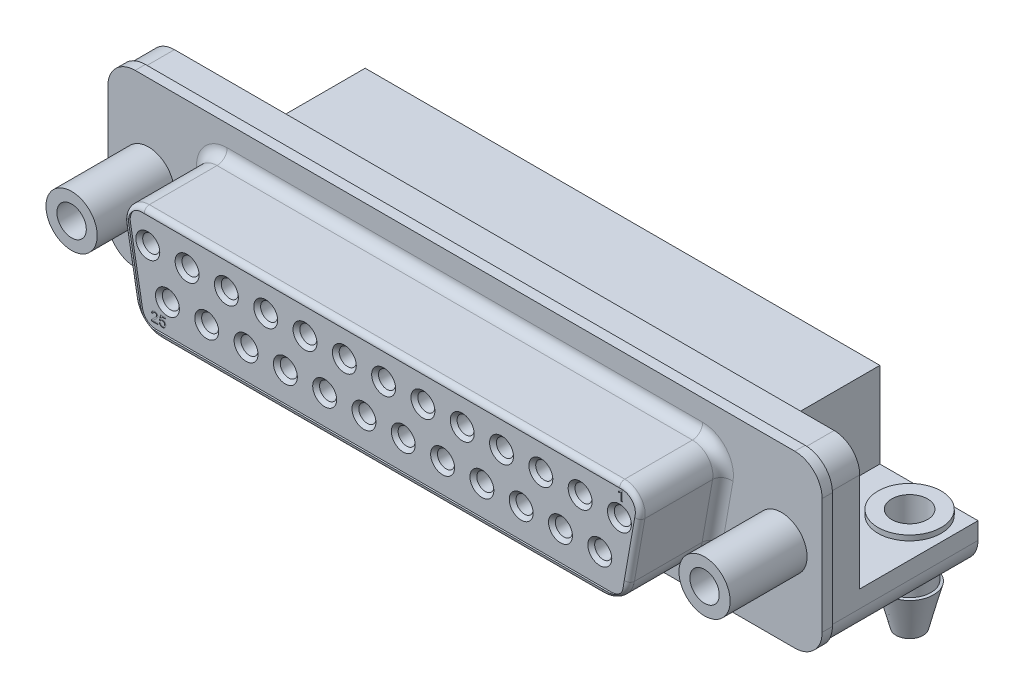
SolidWorks part; units mm, degrees
ref_plane "FRONT" through (0, 0, 0) normal (0, 0, 1) x (1, 0, 0)
ref_plane "TOP" through (0, 0, 0) normal (0, 1, 0) x (1, 0, 0)
ref_plane "RIGHT" through (0, 0, 0) normal (1, 0, 0) x (0, 0, -1)
sketch "Sketch1" plane through (0, 0, 0) normal (0, 0, 1) x (1, 0, 0)
  line L0 (26.545, 0) -> (-26.545, 0) construction
  line L1 (-24.513, -6.3373) -> (24.513, -6.3373)
  line L2 (-26.545, -4.3053) -> (-26.545, 4.3053)
  line L3 (-24.513, 6.3373) -> (24.513, 6.3373)
  line L4 (26.545, -4.3053) -> (26.545, 4.3053)
  line L5 (0, 6.3373) -> (0, -6.3373) construction
  arc A0 (-26.545, -4.3053) -> (-24.513, -6.3373) centre (-24.513, -4.3053) ccw
  arc A1 (-24.513, 6.3373) -> (-26.545, 4.3053) centre (-24.513, 4.3053) ccw
  arc A2 (26.545, 4.3053) -> (24.513, 6.3373) centre (24.513, 4.3053) ccw
  arc A3 (26.545, -4.3053) -> (24.513, -6.3373) centre (24.513, -4.3053) cw
  circle A4 centre (23.5204, 0) radius 1.0922
  circle A5 centre (-23.5204, 0) radius 1.0922
  dimension "D3" = 2.032
  dimension "D4" = 2.1844
  dimension "D5" = 23.5204
  dimension "D1" = 12.6746
  dimension "D2" = 53.09
extrude "Base-Extrude" add sketch "Sketch1" along normal blind 0.762
sketch "Sketch2" plane through (0, 0, 0.762) normal (0, 0, 1) x (1, 0, 0)
  line L0 (0, 6.3373) -> (0, -6.3373) construction
  line L1 (24.513, 6.3373) -> (-24.513, 6.3373) construction
  line L2 (-24.513, -6.3373) -> (24.513, -6.3373) construction
  line L4 (-17.6657, 4.0132) -> (17.6657, 4.0132)
  line L5 (-16.384, -3.8862) -> (16.384, -3.8862)
  line L6 (19.1665, 2.2246) -> (18.3851, -2.2071)
  line L7 (-19.1665, 2.2246) -> (-18.3851, -2.2071)
  arc A0 (19.1665, 2.2246) -> (17.6657, 4.0132) centre (17.6657, 2.4892) ccw
  arc A1 (18.3851, -2.2071) -> (16.384, -3.8862) centre (16.384, -1.8542) cw
  arc A2 (-18.3851, -2.2071) -> (-16.384, -3.8862) centre (-16.384, -1.8542) ccw
  arc A3 (-19.1665, 2.2246) -> (-17.6657, 4.0132) centre (-17.6657, 2.4892) cw
  point P10 (0, 4.0132)
  point P22 (0, -3.8862)
  dimension "D4" = 1.524
  dimension "D5" = 2.032
  dimension "D1" = 38.3794
  dimension "D2" = 100
  dimension "D3" = 7.8994
  dimension "D6" = 2.3241
extrude "Pin  Boss" add sketch "Sketch2" along normal blind 6.1722
fillet "Fillet1" radius 0.762 8 edges at (18.8332, 3.4688, 0.762) (0, 4.0132, 0.762) (-18.8332, 3.4688, 0.762) (-18.7758, 0.0088, 0.762) (-17.6901, -3.4108, 0.762) (0, -3.8862, 0.762) (17.6901, -3.4108, 0.762) (18.7758, 0.0088, 0.762)
fillet "Fillet2" radius 0.381 8 edges at (18.8332, 3.4688, 6.9342) (0, 4.0132, 6.9342) (-18.8332, 3.4688, 6.9342) (-18.7758, 0.0088, 6.9342) (-17.6901, -3.4108, 6.9342) (0, -3.8862, 6.9342) (17.6901, -3.4108, 6.9342) (18.7758, 0.0088, 6.9342)
sketch "Sketch3" plane through (0, 0, 6.9342) normal (0, 0, 1) x (1, 0, 0)
  line L0 (0, 6.3373) -> (0, -6.3373) construction
  line L1 (24.513, 6.3373) -> (-24.513, 6.3373) construction
  line L2 (-24.513, -6.3373) -> (24.513, -6.3373) construction
  line L3 (-17.8171, 3.6322) -> (17.8171, 3.6322)
  line L4 (-16.9168, -3.5052) -> (16.9168, -3.5052)
  line L5 (18.8176, 2.4398) -> (17.9174, -2.6656)
  line L6 (-16.384, -3.5052) -> (16.384, -3.5052) construction
  line L7 (18.0099, -2.1409) -> (18.7913, 2.2907) construction
  line L8 (17.6657, 3.6322) -> (-17.6657, 3.6322) construction
  line L9 (-18.8176, 2.4398) -> (-17.9174, -2.6656)
  arc A0 (18.8176, 2.4398) -> (17.8171, 3.6322) centre (17.8171, 2.6162) ccw
  arc A1 (17.9174, -2.6656) -> (16.9168, -3.5052) centre (16.9168, -2.4892) cw
  arc A2 (-17.9174, -2.6656) -> (-16.9168, -3.5052) centre (-16.9168, -2.4892) ccw
  arc A3 (-18.8176, 2.4398) -> (-17.8171, 3.6322) centre (-17.8171, 2.6162) cw
  point P6 (-17.6657, 3.6322)
  point P9 (0, 3.6322)
  point P15 (17.6657, 3.6322)
  point P28 (0, -3.5052)
  dimension "D2" = 1.016
extrude "Pin Face Releif" cut sketch "Sketch3" against normal blind 0.127
sketch "Sketch5" plane through (0, 0, 0) normal (0, 0, -1) x (-1, 0, 0)
  line L18 (26.418, -4.3053) -> (26.418, 4.3053)
  line L19 (24.513, 6.2103) -> (-24.513, 6.2103)
  line L20 (-26.418, 4.3053) -> (-26.418, -4.3053)
  line L21 (-24.513, -6.2103) -> (24.513, -6.2103)
  line L22 (26.418, -4.3053) -> (26.418, 4.3053)
  line L23 (24.513, 6.2103) -> (-24.513, 6.2103)
  line L24 (-26.418, 4.3053) -> (-26.418, -4.3053)
  line L25 (-24.513, -6.2103) -> (24.513, -6.2103)
  arc A16 (24.513, -6.2103) -> (26.418, -4.3053) centre (24.513, -4.3053) ccw
  arc A17 (26.418, 4.3053) -> (24.513, 6.2103) centre (24.513, 4.3053) ccw
  arc A18 (-24.513, 6.2103) -> (-26.418, 4.3053) centre (-24.513, 4.3053) ccw
  arc A19 (-26.418, -4.3053) -> (-24.513, -6.2103) centre (-24.513, -4.3053) ccw
  arc A20 (24.513, -6.2103) -> (26.418, -4.3053) centre (24.513, -4.3053) ccw
  arc A21 (26.418, 4.3053) -> (24.513, 6.2103) centre (24.513, 4.3053) ccw
  arc A22 (-24.513, 6.2103) -> (-26.418, 4.3053) centre (-24.513, 4.3053) ccw
  arc A23 (-26.418, -4.3053) -> (-24.513, -6.2103) centre (-24.513, -4.3053) ccw
  dimension "D1" = 0.127
extrude "BACKSIDE BOSS" add sketch "Sketch5" along normal offset from surface (2.159 mm away) 2.921
sketch "Sketch7" plane through (0, 0, -2.159) normal (0, 0, -1) x (-1, 0, 0)
  line L0 (24.513, -6.2103) -> (-24.513, -6.2103) construction
  line L1 (24.513, -6.2103) -> (-24.513, -6.2103)
  line L2 (26.418, -3.0353) -> (19.1262, -3.0353)
  line L3 (26.418, 4.3053) -> (26.418, -4.3053) construction
  line L4 (19.1262, -3.0353) -> (19.1262, 3.3147)
  line L5 (19.1262, 3.3147) -> (-19.1262, 3.3147)
  line L6 (0, 0) -> (0, 12.7531) construction
  line L7 (26.418, -3.0353) -> (26.418, -4.3053)
  line L8 (-26.418, -3.0353) -> (-26.418, -4.3053)
  line L13 (-19.1262, -3.0353) -> (-19.1262, 3.3147)
  line L14 (-26.418, -3.0353) -> (-19.1262, -3.0353)
  arc A0 (-26.418, -4.3053) -> (-24.513, -6.2103) centre (-24.513, -4.3053) ccw construction
  arc A1 (24.513, -6.2103) -> (26.418, -4.3053) centre (24.513, -4.3053) ccw construction
  arc A2 (-26.418, -4.3053) -> (-24.513, -6.2103) centre (-24.513, -4.3053) ccw
  arc A3 (24.513, -6.2103) -> (26.418, -4.3053) centre (24.513, -4.3053) ccw
  point P15 (0, 3.3147)
  dimension "D1" = 3.175
  dimension "D2" = 9.525
  dimension "D3" = 38.2524
extrude "backside#2" add sketch "Sketch7" along normal offset from surface (8.7884 mm away) 11.7094
sketch "Sketch10" plane through (0, 0, 6.8072) normal (0, 0, 1) x (1, 0, 0)
  line L0 (0, 0) -> (0, 10.8774) construction
  circle A0 centre (0, 1.5875) radius 0.635
  circle A1 centre (2.921, 1.5875) radius 0.635
  circle A2 centre (5.842, 1.5875) radius 0.635
  circle A3 centre (8.763, 1.5875) radius 0.635
  circle A4 centre (11.684, 1.5875) radius 0.635
  circle A5 centre (14.605, 1.5875) radius 0.635
  circle A6 centre (17.526, 1.5875) radius 0.635
  circle A7 centre (-17.526, 1.5875) radius 0.635
  circle A8 centre (-14.605, 1.5875) radius 0.635
  circle A9 centre (-11.684, 1.5875) radius 0.635
  circle A10 centre (-8.763, 1.5875) radius 0.635
  circle A11 centre (-5.842, 1.5875) radius 0.635
  circle A12 centre (-2.921, 1.5875) radius 0.635
  dimension "D1" = 1.5875
  dimension "D2" = 1.27
extrude "TOP ROW HOLES" cut sketch "Sketch10" against normal blind 6.35
sketch "Sketch11" plane through (0, 0, 6.8072) normal (0, 0, 1) x (1, 0, 0)
  line L0 (-2.921, 1.5875) -> (0, 1.5875) construction
  line L1 (-1.4605, 1.5875) -> (-1.4605, -3.102) construction
  line L2 (-26.289, 1.5875) -> (-23.368, 1.5875) construction
  line L3 (-24.8285, 1.5875) -> (-24.8285, -1.3335) construction
  line L4 (0, 0) -> (0, -9.5373) construction
  circle A1 centre (0, 1.5875) radius 0.635 construction
  circle A2 centre (-4.3815, -1.3335) radius 0.635
  circle A3 centre (-7.3025, -1.3335) radius 0.635
  circle A4 centre (-10.2235, -1.3335) radius 0.635
  circle A5 centre (-13.1445, -1.3335) radius 0.635
  circle A6 centre (-16.0655, -1.3335) radius 0.635
  circle A7 centre (1.4605, -1.3335) radius 0.635
  circle A8 centre (16.0655, -1.3335) radius 0.635
  circle A9 centre (13.1445, -1.3335) radius 0.635
  circle A10 centre (-1.4605, -1.3335) radius 0.635
  circle A11 centre (10.2235, -1.3335) radius 0.635
  circle A12 centre (7.3025, -1.3335) radius 0.635
  circle A13 centre (4.3815, -1.3335) radius 0.635
extrude "BOTTOM ROW HOLES" cut sketch "Sketch11" against normal blind 6.35
chamfer "Chamfer2" distance 0.254 angle 45 25 edges at (0.635, 1.5875, 6.8072) (3.556, 1.5875, 6.8072) (6.477, 1.5875, 6.8072) (9.398, 1.5875, 6.8072) (12.319, 1.5875, 6.8072) (15.24, 1.5875, 6.8072) (18.161, 1.5875, 6.8072) (-18.161, 1.5875, 6.8072) (-15.24, 1.5875, 6.8072) (-12.319, 1.5875, 6.8072) (-9.398, 1.5875, 6.8072) (-6.477, 1.5875, 6.8072) (-3.556, 1.5875, 6.8072) (-3.7465, -1.3335, 6.8072) (-6.6675, -1.3335, 6.8072) (-9.5885, -1.3335, 6.8072) (-12.5095, -1.3335, 6.8072) (-15.4305, -1.3335, 6.8072) (0.8255, -1.3335, 6.8072) (15.4305, -1.3335, 6.8072) (-0.8255, -1.3335, 6.8072) (12.5095, -1.3335, 6.8072) (9.5885, -1.3335, 6.8072) (6.6675, -1.3335, 6.8072) (3.7465, -1.3335, 6.8072)
sketch "Sketch13" plane through (0, -6.2103, 0) normal (0, -1, 0) x (1, 0, 0)
  line L0 (18.6964, -10.8204) -> (19.3314, -10.8204)
  line L1 (18.6964, -10.8204) -> (18.6964, -10.1854)
  line L2 (-16.635, -10.8204) -> (-16, -10.8204)
  line L3 (-16.635, -10.8204) -> (-16.635, -10.1854)
  line L4 (-16.635, -10.1854) -> (-16, -10.1854)
  line L5 (-16, -10.8204) -> (-16, -10.1854)
  line L6 (26.545, 0.762) -> (26.545, 0) construction
  line L7 (26.545, 0.762) -> (26.545, 0) construction
  line L8 (0, 0) -> (0, -18.529) construction
  line L10 (-16.3175, -10.1854) -> (-16.3175, -9.6524) construction
  line L11 (-13.9172, -10.8204) -> (-13.2822, -10.8204)
  line L12 (-13.9172, -10.8204) -> (-13.9172, -10.1854)
  line L13 (-13.9172, -10.1854) -> (-13.2822, -10.1854)
  line L14 (-13.2822, -10.8204) -> (-13.2822, -10.1854)
  line L15 (-11.1994, -10.8204) -> (-10.5644, -10.8204)
  line L16 (-11.1994, -10.8204) -> (-11.1994, -10.1854)
  line L17 (-11.1994, -10.1854) -> (-10.5644, -10.1854)
  line L18 (-10.5644, -10.8204) -> (-10.5644, -10.1854)
  line L19 (-8.4816, -10.8204) -> (-7.8466, -10.8204)
  line L20 (-8.4816, -10.8204) -> (-8.4816, -10.1854)
  line L21 (-8.4816, -10.1854) -> (-7.8466, -10.1854)
  line L22 (-7.8466, -10.8204) -> (-7.8466, -10.1854)
  line L23 (-5.7638, -10.8204) -> (-5.1288, -10.8204)
  line L24 (-5.7638, -10.8204) -> (-5.7638, -10.1854)
  line L25 (-5.7638, -10.1854) -> (-5.1288, -10.1854)
  line L26 (-5.1288, -10.8204) -> (-5.1288, -10.1854)
  line L27 (-3.046, -10.8204) -> (-2.411, -10.8204)
  line L28 (-3.046, -10.8204) -> (-3.046, -10.1854)
  line L29 (-3.046, -10.1854) -> (-2.411, -10.1854)
  line L30 (-2.411, -10.8204) -> (-2.411, -10.1854)
  line L31 (-0.3282, -10.8204) -> (0.3068, -10.8204)
  line L32 (-0.3282, -10.8204) -> (-0.3282, -10.1854)
  line L33 (-0.3282, -10.1854) -> (0.3068, -10.1854)
  line L34 (0.3068, -10.8204) -> (0.3068, -10.1854)
  line L35 (2.3896, -10.8204) -> (3.0246, -10.8204)
  line L36 (2.3896, -10.8204) -> (2.3896, -10.1854)
  line L37 (2.3896, -10.1854) -> (3.0246, -10.1854)
  line L38 (3.0246, -10.8204) -> (3.0246, -10.1854)
  line L39 (5.1074, -10.8204) -> (5.7424, -10.8204)
  line L40 (5.1074, -10.8204) -> (5.1074, -10.1854)
  line L41 (5.1074, -10.1854) -> (5.7424, -10.1854)
  line L42 (5.7424, -10.8204) -> (5.7424, -10.1854)
  line L43 (7.8252, -10.8204) -> (8.4602, -10.8204)
  line L44 (7.8252, -10.8204) -> (7.8252, -10.1854)
  line L45 (7.8252, -10.1854) -> (8.4602, -10.1854)
  line L46 (8.4602, -10.8204) -> (8.4602, -10.1854)
  line L47 (10.543, -10.8204) -> (11.178, -10.8204)
  line L48 (10.543, -10.8204) -> (10.543, -10.1854)
  line L49 (10.543, -10.1854) -> (11.178, -10.1854)
  line L50 (11.178, -10.8204) -> (11.178, -10.1854)
  line L51 (13.2608, -10.8204) -> (13.8958, -10.8204)
  line L52 (13.2608, -10.8204) -> (13.2608, -10.1854)
  line L53 (13.2608, -10.1854) -> (13.8958, -10.1854)
  line L54 (13.8958, -10.8204) -> (13.8958, -10.1854)
  line L55 (15.9786, -10.8204) -> (16.6136, -10.8204)
  line L56 (15.9786, -10.8204) -> (15.9786, -10.1854)
  line L57 (15.9786, -10.1854) -> (16.6136, -10.1854)
  line L58 (16.6136, -10.8204) -> (16.6136, -10.1854)
  line L59 (18.6964, -10.1854) -> (19.3314, -10.1854)
  line L60 (19.3314, -10.8204) -> (19.3314, -10.1854)
  line L61 (21.4142, -10.8204) -> (22.0492, -10.8204)
  line L62 (21.4142, -10.8204) -> (21.4142, -10.1854)
  line L63 (21.4142, -10.1854) -> (22.0492, -10.1854)
  line L64 (22.0492, -10.8204) -> (22.0492, -10.1854)
  line L65 (24.132, -10.8204) -> (24.767, -10.8204)
  line L66 (24.132, -10.8204) -> (24.132, -10.1854)
  line L67 (24.132, -10.1854) -> (24.767, -10.1854)
  line L68 (24.767, -10.8204) -> (24.767, -10.1854)
  line L69 (26.8498, -10.8204) -> (27.4848, -10.8204)
  line L70 (26.8498, -10.8204) -> (26.8498, -10.1854)
  line L71 (26.8498, -10.1854) -> (27.4848, -10.1854)
  line L72 (27.4848, -10.8204) -> (27.4848, -10.1854)
  line L73 (29.5676, -10.8204) -> (30.2026, -10.8204)
  line L74 (29.5676, -10.8204) -> (29.5676, -10.1854)
  line L75 (29.5676, -10.1854) -> (30.2026, -10.1854)
  line L76 (30.2026, -10.8204) -> (30.2026, -10.1854)
  line L77 (32.2854, -10.8204) -> (32.9204, -10.8204)
  line L78 (32.2854, -10.8204) -> (32.2854, -10.1854)
  line L79 (32.2854, -10.1854) -> (32.9204, -10.1854)
  line L80 (32.9204, -10.8204) -> (32.9204, -10.1854)
  line L81 (17.3502, -7.4498) -> (17.9852, -7.4498)
  line L82 (17.3502, -7.4498) -> (17.3502, -8.0848)
  line L83 (-14.9459, -8.0848) -> (-14.9459, -8.3778) construction
  line L84 (-15.2634, -7.4498) -> (-14.6284, -7.4498)
  line L85 (-15.2634, -7.4498) -> (-15.2634, -8.0848)
  line L86 (-15.2634, -8.0848) -> (-14.6284, -8.0848)
  line L87 (-14.6284, -7.4498) -> (-14.6284, -8.0848)
  line L88 (-12.5456, -7.4498) -> (-11.9106, -7.4498)
  line L89 (-12.5456, -7.4498) -> (-12.5456, -8.0848)
  line L90 (-12.5456, -8.0848) -> (-11.9106, -8.0848)
  line L91 (-11.9106, -7.4498) -> (-11.9106, -8.0848)
  line L92 (-12.2281, -8.0848) -> (-12.2281, -8.3778) construction
  line L93 (-9.8278, -7.4498) -> (-9.1928, -7.4498)
  line L94 (-9.8278, -7.4498) -> (-9.8278, -8.0848)
  line L95 (-9.8278, -8.0848) -> (-9.1928, -8.0848)
  line L96 (-9.1928, -7.4498) -> (-9.1928, -8.0848)
  line L97 (-9.5103, -8.0848) -> (-9.5103, -8.3778) construction
  line L98 (-7.11, -7.4498) -> (-6.475, -7.4498)
  line L99 (-7.11, -7.4498) -> (-7.11, -8.0848)
  line L100 (-7.11, -8.0848) -> (-6.475, -8.0848)
  line L101 (-6.475, -7.4498) -> (-6.475, -8.0848)
  line L102 (-6.7925, -8.0848) -> (-6.7925, -8.3778) construction
  line L103 (-4.3922, -7.4498) -> (-3.7572, -7.4498)
  line L104 (-4.3922, -7.4498) -> (-4.3922, -8.0848)
  line L105 (-4.3922, -8.0848) -> (-3.7572, -8.0848)
  line L106 (-3.7572, -7.4498) -> (-3.7572, -8.0848)
  line L107 (-4.0747, -8.0848) -> (-4.0747, -8.3778) construction
  line L108 (-1.6744, -7.4498) -> (-1.0394, -7.4498)
  line L109 (-1.6744, -7.4498) -> (-1.6744, -8.0848)
  line L110 (-1.6744, -8.0848) -> (-1.0394, -8.0848)
  line L111 (-1.0394, -7.4498) -> (-1.0394, -8.0848)
  line L112 (-1.3569, -8.0848) -> (-1.3569, -8.3778) construction
  line L113 (1.0434, -7.4498) -> (1.6784, -7.4498)
  line L114 (1.0434, -7.4498) -> (1.0434, -8.0848)
  line L115 (1.0434, -8.0848) -> (1.6784, -8.0848)
  line L116 (1.6784, -7.4498) -> (1.6784, -8.0848)
  line L117 (1.3609, -8.0848) -> (1.3609, -8.3778) construction
  line L118 (3.7612, -7.4498) -> (4.3962, -7.4498)
  line L119 (3.7612, -7.4498) -> (3.7612, -8.0848)
  line L120 (3.7612, -8.0848) -> (4.3962, -8.0848)
  line L121 (4.3962, -7.4498) -> (4.3962, -8.0848)
  line L122 (4.0787, -8.0848) -> (4.0787, -8.3778) construction
  line L123 (6.479, -7.4498) -> (7.114, -7.4498)
  line L124 (6.479, -7.4498) -> (6.479, -8.0848)
  line L125 (6.479, -8.0848) -> (7.114, -8.0848)
  line L126 (7.114, -7.4498) -> (7.114, -8.0848)
  line L127 (6.7965, -8.0848) -> (6.7965, -8.3778) construction
  line L128 (9.1968, -7.4498) -> (9.8318, -7.4498)
  line L129 (9.1968, -7.4498) -> (9.1968, -8.0848)
  line L130 (9.1968, -8.0848) -> (9.8318, -8.0848)
  line L131 (9.8318, -7.4498) -> (9.8318, -8.0848)
  line L132 (9.5143, -8.0848) -> (9.5143, -8.3778) construction
  line L133 (11.9146, -7.4498) -> (12.5496, -7.4498)
  line L134 (11.9146, -7.4498) -> (11.9146, -8.0848)
  line L135 (11.9146, -8.0848) -> (12.5496, -8.0848)
  line L136 (12.5496, -7.4498) -> (12.5496, -8.0848)
  line L137 (12.2321, -8.0848) -> (12.2321, -8.3778) construction
  line L138 (14.6324, -7.4498) -> (15.2674, -7.4498)
  line L139 (14.6324, -7.4498) -> (14.6324, -8.0848)
  line L140 (14.6324, -8.0848) -> (15.2674, -8.0848)
  line L141 (15.2674, -7.4498) -> (15.2674, -8.0848)
  line L142 (14.9499, -8.0848) -> (14.9499, -8.3778) construction
  line L143 (17.3502, -8.0848) -> (17.9852, -8.0848)
  line L144 (17.9852, -7.4498) -> (17.9852, -8.0848)
  line L145 (17.6677, -8.0848) -> (17.6677, -8.3778) construction
  line L146 (20.068, -7.4498) -> (20.703, -7.4498)
  line L147 (20.068, -7.4498) -> (20.068, -8.0848)
  line L148 (20.068, -8.0848) -> (20.703, -8.0848)
  line L149 (20.703, -7.4498) -> (20.703, -8.0848)
  line L150 (20.3855, -8.0848) -> (20.3855, -8.3778) construction
  line L151 (22.7858, -7.4498) -> (23.4208, -7.4498)
  line L152 (22.7858, -7.4498) -> (22.7858, -8.0848)
  line L153 (22.7858, -8.0848) -> (23.4208, -8.0848)
  line L154 (23.4208, -7.4498) -> (23.4208, -8.0848)
  line L155 (23.1033, -8.0848) -> (23.1033, -8.3778) construction
  line L156 (25.5036, -7.4498) -> (26.1386, -7.4498)
  line L157 (25.5036, -7.4498) -> (25.5036, -8.0848)
  line L158 (25.5036, -8.0848) -> (26.1386, -8.0848)
  line L159 (26.1386, -7.4498) -> (26.1386, -8.0848)
  line L160 (25.8211, -8.0848) -> (25.8211, -8.3778) construction
  line L161 (28.2214, -7.4498) -> (28.8564, -7.4498)
  line L162 (28.2214, -7.4498) -> (28.2214, -8.0848)
  line L163 (28.2214, -8.0848) -> (28.8564, -8.0848)
  line L164 (28.8564, -7.4498) -> (28.8564, -8.0848)
  line L165 (28.5389, -8.0848) -> (28.5389, -8.3778) construction
  line L166 (30.9392, -7.4498) -> (31.5742, -7.4498)
  line L167 (30.9392, -7.4498) -> (30.9392, -8.0848)
  line L168 (30.9392, -8.0848) -> (31.5742, -8.0848)
  line L169 (31.5742, -7.4498) -> (31.5742, -8.0848)
  line L170 (31.2567, -8.0848) -> (31.2567, -8.3778) construction
  line L174 (-25.3418, -10.8204) -> (-24.155, -10.8204) construction
  line L175 (-24.513, -10.9474) -> (24.513, -10.9474) construction
  dimension "D1" = 0.635
  dimension "D2" = 0.635
  dimension "D3" = 43.18
  dimension "D4" = 16.3175
  dimension "D5" = 1.3716
  dimension "D6" = 2.7356
  dimension "D7" = 0.127
  dimension "D8" = 2.7178
  dimension "D9" = 2.7178
  dimension "D10" = 33.2486
extrude "pins pins pins" add sketch "Sketch13" along normal blind 4.2418
sketch "Sketch15" plane through (0, 0, 0.762) normal (0, 0, 1) x (1, 0, 0)
  circle A0 centre (23.5204, 0) radius 1.905
  circle A1 centre (-23.5204, 0) radius 1.905
  circle A2 centre (-23.5204, 0) radius 1.0922 construction
  circle A3 centre (23.5204, 0) radius 1.0922 construction
  circle A4 centre (-23.5204, 0) radius 1.0922
  circle A5 centre (23.5204, 0) radius 1.0922
  dimension "D1" = 3.81
extrude "Threadedstandoffs" add sketch "Sketch15" along normal blind 5.715
sketch "Sketch16" plane through (0, -3.0353, 0) normal (0, 1, 0) x (-1, 0, 0)
  line L0 (0, -26.406) -> (0, 0) construction
  line L1 (-24.513, 0.762) -> (24.513, 0.762) construction
  circle A0 centre (-23.5204, -8.763) radius 1.5875
  circle A1 centre (23.5204, -8.763) radius 1.5875
  dimension "D1" = 47.0408
  dimension "D2" = 3.175
  dimension "D3" = 9.525
extrude "mount holes" cut sketch "Sketch16" against normal through all
ref_plane "MOUNT BOSS PLANE" through (0, 0, -8.763) normal (0, 0, -1) x (-1, 0, 0)
sketch "Sketch17" plane through (0, 0, -8.763) normal (0, 0, -1) x (-1, 0, 0)
  line L0 (-21.1709, -3.0353) -> (-21.1709, -2.6543)
  line L1 (-26.418, -3.0353) -> (-19.1262, -3.0353) construction
  line L2 (-21.1709, -2.6543) -> (-22.1869, -2.6543)
  line L3 (-21.1709, -3.0353) -> (-21.9329, -3.0353)
  line L4 (-21.9329, -3.0353) -> (-21.9329, -7.2263)
  line L5 (-21.9329, -7.2263) -> (-21.7424, -7.2752)
  line L6 (-21.7424, -7.2752) -> (-22.5124, -10.2743)
  line L7 (-22.5124, -10.2743) -> (-22.7584, -10.2111)
  line L8 (-22.7584, -10.2111) -> (-22.0516, -7.4581)
  line L9 (-22.0516, -7.4581) -> (-22.1869, -7.4233)
  line L10 (-22.1869, -7.4233) -> (-22.1869, -2.6543)
  line L11 (-23.5204, -6.9043) -> (-23.5204, -2.1392) construction
  line L12 (-23.5204, -6.2103) -> (-23.5204, -3.0353) construction
  line L13 (-21.9329, -6.2103) -> (-21.9329, -3.0353) construction
  line L14 (24.513, -6.2103) -> (-24.513, -6.2103) construction
  dimension "D1" = 4.699
  dimension "D2" = 0.381
  dimension "D3" = 0.254
  dimension "D4" = 3.556
  dimension "D5" = 0.254
  dimension "D6" = 0.254
  dimension "D7" = 1.524
  dimension "D8" = 1.016
  dimension "D9" = 4.064
revolve "SNAP IN PEG" add sketch "Sketch17" angle 360 about L11
mirror "Mirror1" about plane through (0, 0, 0) normal (1, 0, 0) of "SNAP IN PEG"
sketch "Sketch18" plane through (0, 0, 6.8072) normal (0, 0, 1) x (1, 0, 0)
  text T0 "1" font "Arial" height 0.762
extrude "1 pin" cut sketch "Sketch18" against normal blind 0.0254
sketch "Sketch19" plane through (0, 0, 6.8072) normal (0, 0, 1) x (1, 0, 0)
  text T0 "25" font "Arial" height 0.762
extrude "25PIN" cut sketch "Sketch19" against normal blind 0.0254
